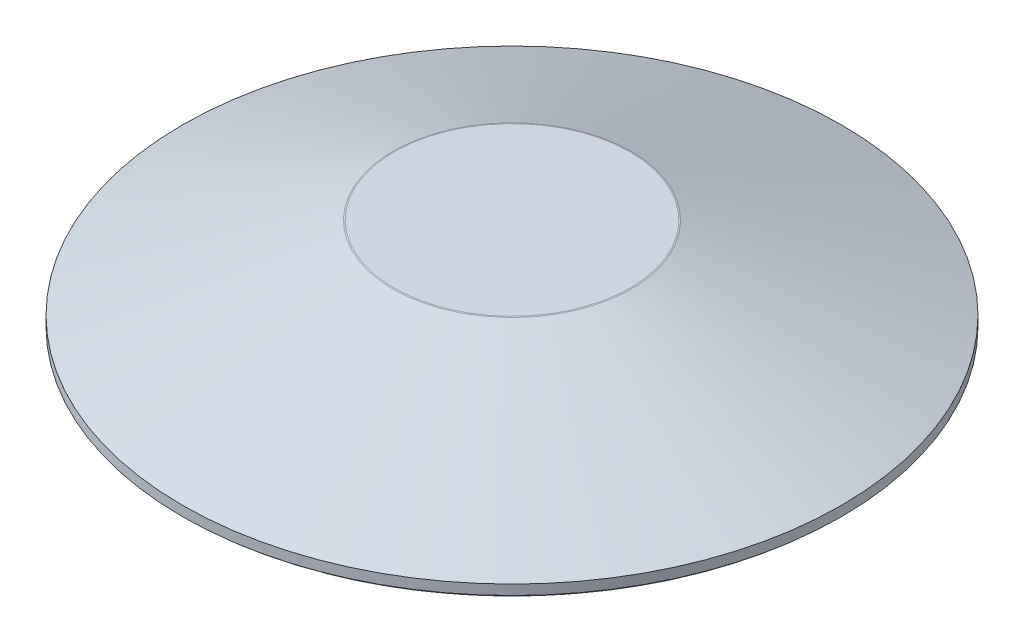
SolidWorks part; units mm, degrees
ref_plane "Front Plane" through (0, 0, 0) normal (0, 0, 1) x (1, 0, 0)
ref_plane "Top Plane" through (0, 0, 0) normal (0, 1, 0) x (1, 0, 0)
ref_plane "Right Plane" through (0, 0, 0) normal (1, 0, 0) x (0, 0, -1)
sketch "Sketch1" plane through (0, 0, 0) normal (0, 0, 1) x (1, 0, 0)
  line L0 (0, 0) -> (0, 2.5819) construction
  line L1 (0, 3.8) -> (1.8, 3.8)
  line L2 (1.8, 3.8) -> (5, 2.55)
  line L3 (5, 2.55) -> (5, 2.4)
  line L4 (5, 2.4) -> (4.5, 2.4)
  line L5 (1.075, 2.4) -> (1.075, 1.2)
  line L6 (0.9, 0.15) -> (0.9, 0)
  line L7 (0.9, 0) -> (0, 0)
  line L8 (0, 0) -> (0, 3.8)
  line L9 (0.9, 0.15) -> (1.075, 0.325)
  line L10 (2.6, 1.7847) -> (2.6, 0.0809) construction
  line L11 (1.9, 2.4) -> (1.9, 3.05)
  line L12 (1.9, 3.05) -> (4.5, 2.4)
  line L13 (1.9, 2.4) -> (1.075, 2.4)
  arc A2 (1.075, 1.2) -> (1.075, 0.325) centre (0.7622, 0.7625) cw
  arc A3 (4.5, 2.4) -> (5, 2.4) centre (4.75, 2.6477) ccw
  point P12 (1.3, 0.7625)
  dimension "D1" = 1.8
  dimension "D2" = 2.15
  dimension "D3" = 10
  dimension "D4" = 3.8
  dimension "D5" = 1.4
  dimension "D6" = 3.6
  dimension "D7" = 0.15
  dimension "D8" = 0.15
  dimension "D9" = 2.6
  dimension "D10" = 1.2
  dimension "D11" = 135
  dimension "D12" = 2.6
  dimension "D13" = 3.8
  dimension "D14" = 0.5
  dimension "D15" = 0.65
revolve "Revolve1" add sketch "Sketch1" angle 360 about L0
fillet "Fillet1" radius 0.05 7 edges at (0, 3.8, -1.8) (0, 3.05, -1.9) (0, 2.4, -1.9) (0, 2.4, -1.075) (0, 0.15, -0.9) (0, 1.2, -1.075) (0, 0.325, -1.075)
